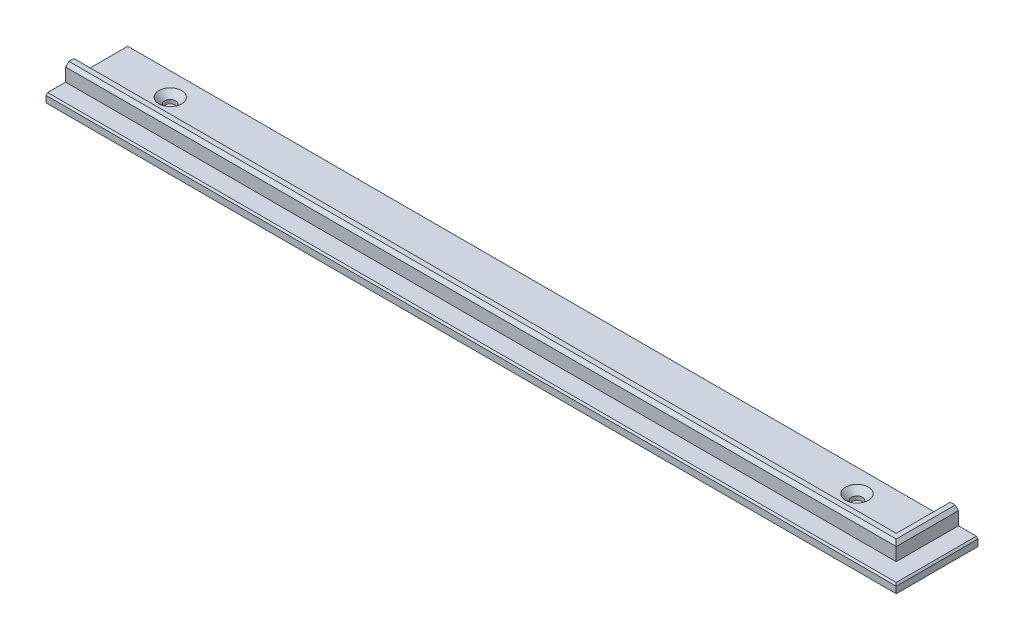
SolidWorks part; units mm, degrees
ref_plane "Ebene vorne" through (0, 0, 0) normal (0, 0, 1) x (1, 0, 0)
ref_plane "Ebene oben" through (0, 0, 0) normal (0, 1, 0) x (1, 0, 0)
ref_plane "Ebene rechts" through (0, 0, 0) normal (1, 0, 0) x (0, 0, -1)
sketch "Skizze1" plane through (0, 0, 0) normal (0, 1, 0) x (1, 0, 0)
  line L1 (-130, -12.5) -> (130, -12.5)
  line L2 (-130, -12.5) -> (-130, 12.5)
  line L3 (-130, 12.5) -> (130, 12.5)
  line L4 (130, -12.5) -> (130, 12.5)
  line L5 (-130, -12.5) -> (130, 12.5) construction
  line L6 (-130, 12.5) -> (130, -12.5) construction
  point P0 (0, 0)
  dimension "D1" = 260
  dimension "D2" = 25
extrude "Aufsatz-Linear austragen1" add sketch "Skizze1" along normal blind 3
sketch "Skizze2" plane through (0, 3, 0) normal (0, 1, 0) x (1, 0, 0)
  line L0 (-130, 12.5) -> (-130, -12.5) construction
  line L1 (-130, -3.5) -> (121, -3.5)
  line L2 (-130, -3.5) -> (-130, -6.5)
  line L3 (-130, -6.5) -> (124, -6.5)
  line L6 (-130, -12.5) -> (130, -12.5) construction
  line L7 (124, 12.5) -> (124, -6.5)
  line L8 (130, 12.5) -> (-130, 12.5) construction
  line L9 (124, 12.5) -> (121, 12.5)
  line L10 (121, 12.5) -> (121, -3.5)
  line L11 (130, -12.5) -> (130, 12.5) construction
  dimension "D1" = 6
  dimension "D2" = 3
  dimension "D3" = 6
extrude "Aufsatz-Linear austragen2" add sketch "Skizze2" along normal blind 5
chamfer "Fase1" distance 0.5 angle 45 8 edges at (130, 3, 0) (0, 3, 12.5) (0, 0, -12.5) (-130, 0, 0) (0, 0, 12.5) (130, 0, 0) (-4.5, 8, 3.5) (121, 8, -4.5)
chamfer "Fase2" distance 1 angle 45 2 edges at (-3, 8, 6.5) (124, 8, -3)
hole_wizard "Formsenkung für M3 Senkschraube mit Innensechskant1" positions "Skizze3" profile "Skizze4" countersink size "M3" standard "DIN"
sketch "Skizze3" plane through (0, 3, 0) normal (0, 1, 0) x (1, 0, 0)
  line L0 (130, -12.5) -> (-130, -12.5) construction
  line L1 (130, 12.5) -> (130, -12.5) construction
  line L3 (-130, 12.5) -> (-130, -3.5) construction
  point P0 (100, 5.5)
  point P4 (-110, 5.5)
  dimension "D1" = 18
  dimension "D2" = 30
  dimension "D3" = 20
sketch "Skizze4" plane through (100, 3, -5.5) normal (1, 0, 0) x (0, 0, 1)
  line L0 (0, 0) -> (0, 3)
  line L1 (0, 3) -> (1.7, 3)
  line L2 (1.7, 3) -> (1.7, 1.8)
  line L3 (1.7, 1.8) -> (3.5, 0)
  line L5 (3.5, 0) -> (0, 0)
  line L6 (-1.7, 1.8) -> (-3.5, 0) construction
  line L11 (0, -6.35) -> (0, 107.95) construction
  dimension "Bohrerdurchmesser" = 3.4
  dimension "Bohrungstiefe" = 3
  dimension "Senkdurchmesser (Oben)" = 7
  dimension "Senkwinkel (Oben)" = 90
